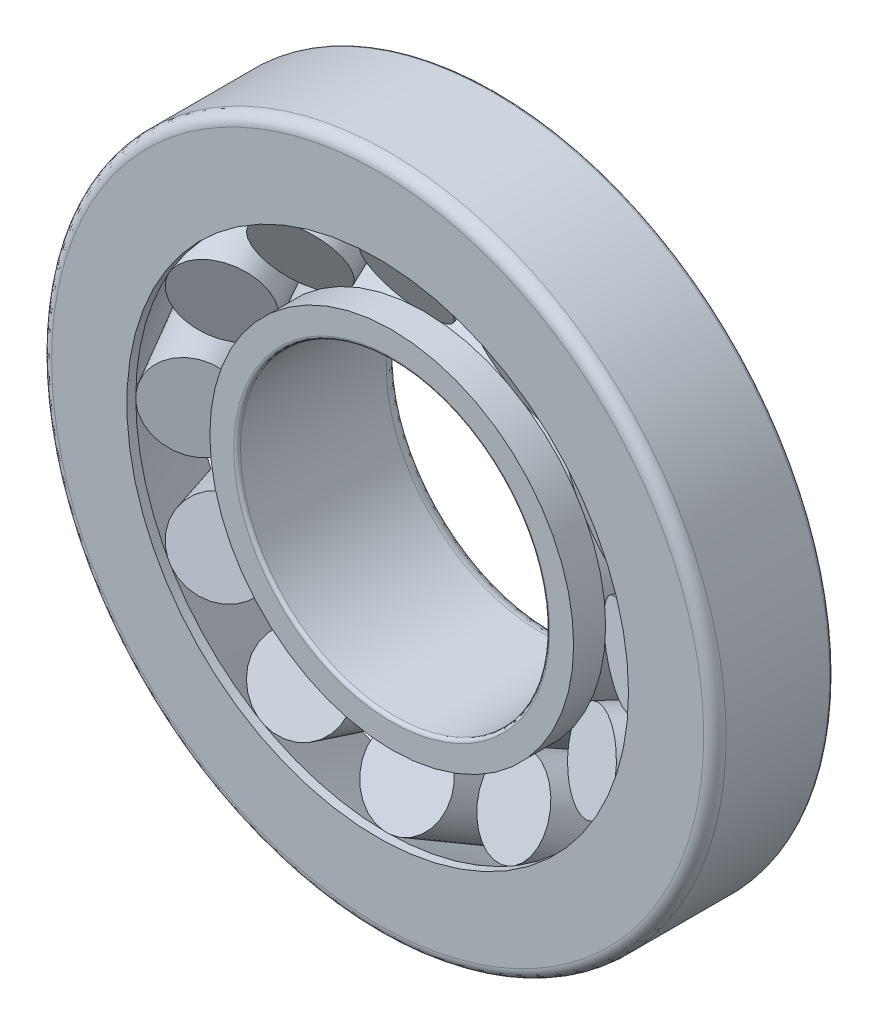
SolidWorks part; units mm, degrees
ref_plane "Front Plane" through (0, 0, 0) normal (0, 0, 1) x (1, 0, 0)
ref_plane "Top Plane" through (0, 0, 0) normal (0, 1, 0) x (1, 0, 0)
ref_plane "Right Plane" through (0, 0, 0) normal (1, 0, 0) x (0, 0, -1)
sketch "BaseSke" plane through (0, 0, 0) normal (1, 0, 0) x (0, 0, -1)
  line L0 (-47.2296, 0) -> (24.6132, 0) construction
  line L2 (0, 129.5214) -> (0, -86.3012) construction
  line L3 (2.5584, 53.7985) -> (-34.0584, 33.7015) construction
  line L4 (-31.5, 60) -> (-10.5, 60) construction
  line L5 (-29, 27.5) -> (0, 27.5) construction
  line L6 (-15.75, 43.75) -> (-28.7741, 67.48) construction
  line L7 (-29.925, 44.6425) -> (-12.075, 55.0565)
  line L8 (-12.075, 55.0565) -> (-8.1568, 47.9175)
  line L9 (-8.1568, 47.9175) -> (-26.2671, 37.9778)
  line L10 (-26.2671, 37.9778) -> (-29.925, 44.6425)
  line L11 (-31.5, 60) -> (-31.5, 44.625) construction
  line L12 (-29.9154, 44.625) -> (-10.5, 55.9523) construction
  line L13 (-10.5, 60) -> (-10.5, 55.9523) construction
  line L14 (-29.9154, 44.625) -> (-31.5, 44.625) construction
  line L15 (-22.6091, 31.313) -> (-4.2386, 40.7785) construction
  line L16 (-29, 27.5) -> (-29, 32.363) construction
  line L17 (-29, 32.363) -> (-23.2995, 32.363) construction
  line L18 (0, 41.8285) -> (0, 27.5) construction
  line L19 (-23.2995, 32.363) -> (-22.7221, 31.311) construction
  line L20 (-22.7221, 31.311) -> (-4.1737, 40.8682) construction
  line L21 (-4.1737, 40.8682) -> (-4.7008, 41.8285) construction
  line L22 (-4.7008, 41.8285) -> (0, 41.8285) construction
  dimension "D2" = 15.75
  dimension "D1" = 0.02
  dimension "Outer_Thickness" = 21
  dimension "Bearing_Outside_Diameter" = 120
  dimension "Bearing_Inside_Diameter" = 55
  dimension "Inner_Thickness" = 29
  dimension "Bearing_Thickness" = 31.5
  dimension "Angle" = 28.76
  dimension "D3" = 87.5
  dimension "D4" = 1.575
  dimension "D5" = 1.575
  dimension "D6" = 1.5
  dimension "D7" = 0.1
  dimension "Roller_diameter" = 89.25
  dimension "D8" = 1.05
  dimension "D9" = 0.05
  dimension "D10" = 0.1
  dimension "D11" = 1.05
revolve "Roller" add sketch "BaseSke" angle 360 about L3
sketch "OuterRaceSke" plane through (0, 0, 0) normal (1, 0, 0) x (0, 0, -1)
  line L0 (-29.9154, 44.625) -> (-31.5, 44.625) construction
  line L1 (-29.9154, 44.625) -> (-10.5, 55.9523) construction
  line L2 (-10.5, 60) -> (-10.5, 55.9523) construction
  line L3 (-31.5, 60) -> (-10.5, 60) construction
  line L4 (-31.5, 60) -> (-31.5, 44.625) construction
  line L5 (-29.9154, 44.625) -> (-31.5, 44.625)
  line L6 (-29.9154, 44.625) -> (-10.5, 55.9523)
  line L7 (-10.5, 60) -> (-10.5, 55.9523)
  line L8 (-31.5, 60) -> (-10.5, 60)
  line L9 (-31.5, 60) -> (-31.5, 44.625)
  line L10 (-60.3939, 0) -> (35.9926, 0) construction
revolve "OuterRace" add sketch "OuterRaceSke" angle 360 about L10
sketch "InnerRaceSke" plane through (0, 0, 0) normal (1, 0, 0) x (0, 0, -1)
  line L0 (-29, 27.5) -> (0, 27.5) construction
  line L1 (-29, 27.5) -> (-29, 32.363) construction
  line L2 (-29, 32.363) -> (-23.2995, 32.363) construction
  line L3 (-23.2995, 32.363) -> (-22.7221, 31.311) construction
  line L4 (-22.7221, 31.311) -> (-4.1737, 40.8682) construction
  line L5 (-4.1737, 40.8682) -> (-4.7008, 41.8285) construction
  line L6 (-4.7008, 41.8285) -> (0, 41.8285) construction
  line L7 (0, 41.8285) -> (0, 27.5) construction
  line L8 (-29, 27.5) -> (0, 27.5)
  line L9 (-29, 27.5) -> (-29, 32.363)
  line L10 (-29, 32.363) -> (-23.2995, 32.363)
  line L11 (-23.2995, 32.363) -> (-22.7221, 31.311)
  line L12 (-22.7221, 31.311) -> (-4.1737, 40.8682)
  line L13 (-4.1737, 40.8682) -> (-4.7008, 41.8285)
  line L14 (-4.7008, 41.8285) -> (0, 41.8285)
  line L15 (0, 41.8285) -> (0, 27.5)
  line L16 (-58.1022, 0) -> (39.538, 0) construction
revolve "InnerRace" add sketch "InnerRaceSke" angle 360 about L16
fillet "Fillet1" radius 0.6 2 edges at (60, 0, 10.5) (27.5, 0, 29)
fillet "InnerFillet" radius 2.5 1 edges at (27.5, 0, 0)
fillet "OuterFillet" radius 2 1 edges at (60, 0, 31.5)
pattern_circular "CirPatternBall" count 12 over 360 about axis through (0, 0, 0) along (0, 0, 1) of "Roller"
sketch "Sketch4" plane through (0, 0, 0) normal (1, 0, 0) x (0, 0, -1)
  line L0 (-29.925, 44.6425) -> (-12.075, 55.0565)
  line L1 (-12.075, 55.0565) -> (-4.2386, 40.7785)
  line L2 (-4.2386, 40.7785) -> (-22.6091, 31.313)
  line L3 (-22.6091, 31.313) -> (-29.925, 44.6425)
  line L4 (-40.3293, 0) -> (19.5574, 0) construction
revolve "Simplified" [suppressed] add sketch "Sketch4" angle 360 about L4
equation "\"D2@BaseSke\" = \"Bearing_Thickness@BaseSke\"/2"
equation "\"D3@BaseSke\" =  ( \"Bearing_Outside_Diameter@BaseSke\" + \"Bearing_Inside_Diameter@BaseSke\" )  / 2"
equation "\"Roller_diameter@BaseSke\" = \"D3@BaseSke\"*1.02"
equation "\"D4@BaseSke\" = \"Bearing_Thickness@BaseSke\"/20"
equation "\"D5@BaseSke\" = \"Bearing_Thickness@BaseSke\" / 20"
equation "\"D8@BaseSke\" = \"Bearing_Thickness@BaseSke\"/30"
equation "\"D11@BaseSke\" = \"D8@BaseSke\""
equation "\"D1@CirPatternBall\" = int(  \"D3@BaseSke\" *  pi  /  ( \"Bearing_Outside_Diameter@BaseSke\" - \"Bearing_Inside_Diameter@BaseSke\" )  * 3) "
